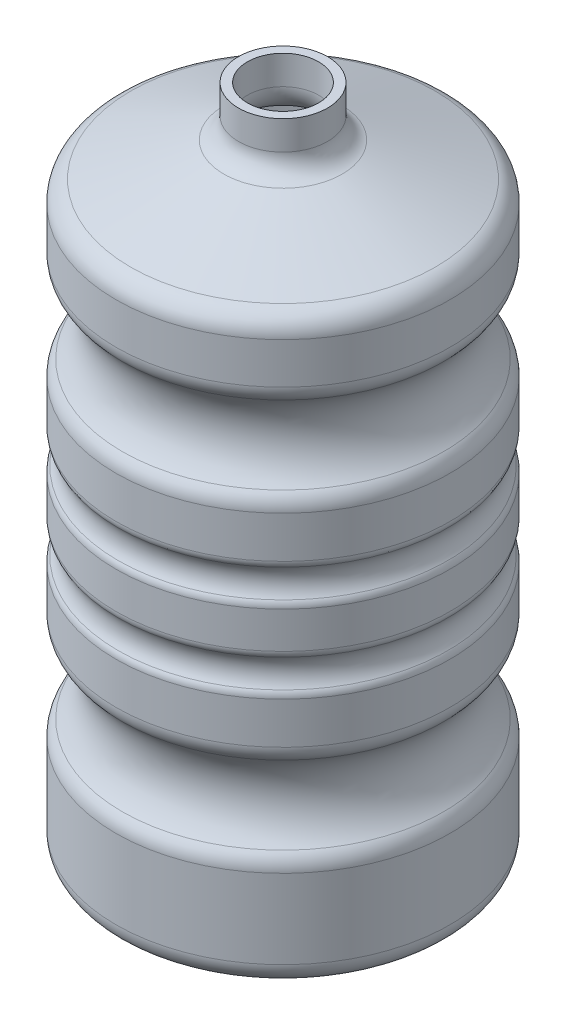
SolidWorks part; units mm, degrees
ref_plane "Front Plane" through (0, 0, 0) normal (0, 0, 1) x (1, 0, 0)
ref_plane "Top Plane" through (0, 0, 0) normal (0, 1, 0) x (1, 0, 0)
ref_plane "Right Plane" through (0, 0, 0) normal (1, 0, 0) x (0, 0, -1)
sketch "Sketch1" plane through (0, 0, 0) normal (1, 0, 0) x (0, 0, -1)
  line L0 (0, 10) -> (0, 300)
  line L1 (0, 300) -> (20, 300)
  line L2 (20, 300) -> (20, 280)
  line L3 (20, 280) -> (75, 259.9816)
  line L4 (75, 259.9816) -> (75, 230)
  line L5 (75, 0) -> (40, 0)
  line L6 (65, 210) -> (65, 70) construction
  line L7 (75, 190) -> (75, 165)
  line L8 (75, 50) -> (75, 0)
  line L9 (72, 157.5) -> (72, 122.5) construction
  line L10 (75, 150) -> (75, 130)
  line L11 (75, 115) -> (75, 90)
  line L12 (0, 10) -> (-85.383, 10) construction
  arc A0 (75, 230) -> (75, 190) centre (90, 210) ccw
  arc A1 (75, 90) -> (75, 50) centre (90, 70) ccw
  arc A2 (75, 165) -> (75, 150) centre (82.875, 157.5) ccw
  arc A3 (75, 130) -> (75, 115) centre (82.875, 122.5) ccw
  arc A4 (0, 10) -> (40, 0) centre (0, -75) cw
  point P0 (0, 0)
  point P26 (-85.383, 11.075)
  dimension "D6" = 50
  dimension "D10" = 3
  dimension "D11" = 15
  dimension "D14" = 10
  dimension "D15" = 35
  dimension "D2" = 75
  dimension "D3" = 20
  dimension "D4" = 110
  dimension "D5" = 20
  dimension "D7" = 40
  dimension "D8" = 140
  dimension "D9" = 10
  dimension "D12" = 25
  dimension "D13" = 25
revolve "Revolve1" add sketch "Sketch1" angle 360 about L0
fillet "Fillet1" radius 10 7 edges at (0, 50, -75) (0, 190, -75) (0, 230, -75) (0, 0, -75) (0, 259.9816, -75) (0, 280, -20) (0, 90, -75)
fillet "Fillet2" radius 5 4 edges at (0, 115, -75) (0, 130, -75) (0, 150, -75) (0, 165, -75)
shell "Shell1" thickness 4
